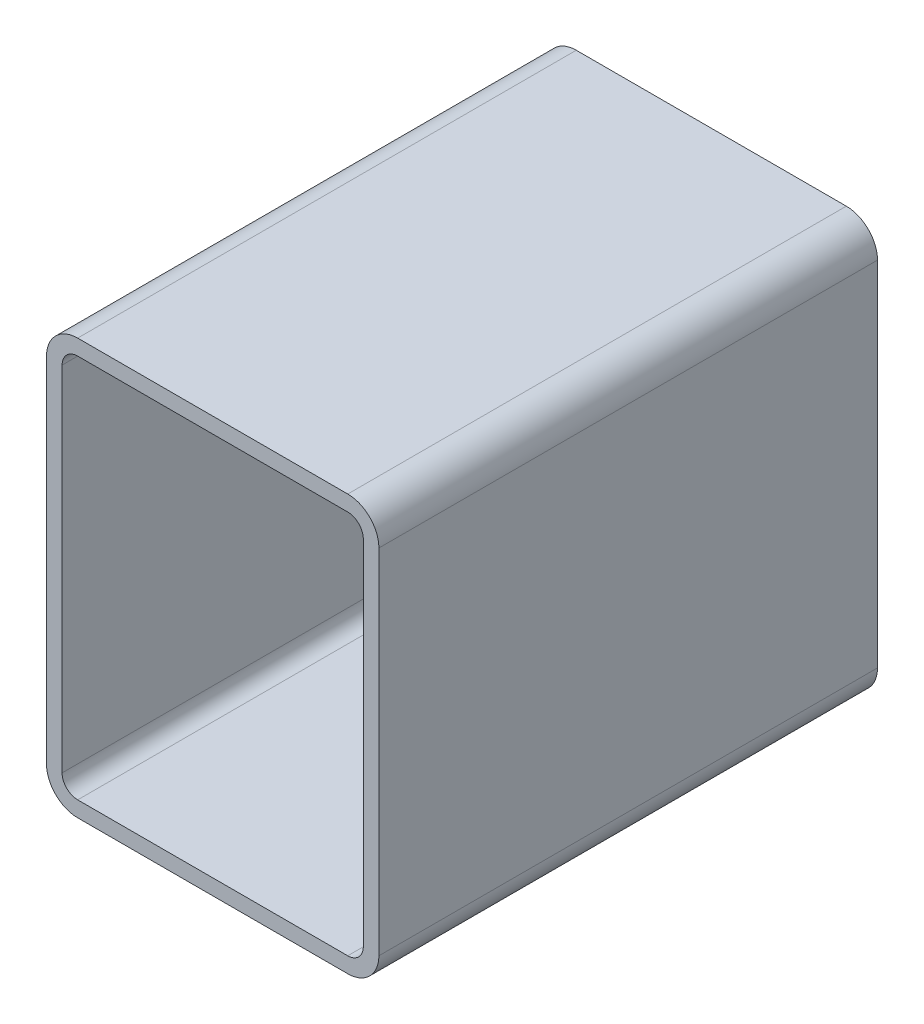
SolidWorks part; units mm, degrees
ref_plane "Front Plane" through (0, 0, 0) normal (0, 0, 1) x (1, 0, 0)
ref_plane "Top Plane" through (0, 0, 0) normal (0, 1, 0) x (1, 0, 0)
ref_plane "Right Plane" through (0, 0, 0) normal (1, 0, 0) x (0, 0, -1)
sketch "Sketch1" plane through (0, 0, 0) normal (0, 0, 1) x (1, 0, 0)
sketch_block_instance "HSS10x8x0.375-1"
sketch_block "HSS10x8x0.375"
extrude "Boss-Extrude1" add sketch "Sketch1" along normal blind 304.8
